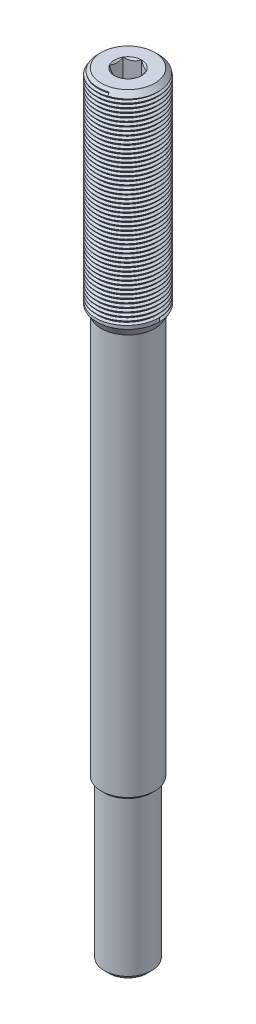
SolidWorks part; units mm, degrees
ref_plane "前视基准面" through (0, 0, 0) normal (0, 0, 1) x (1, 0, 0)
ref_plane "上视基准面" through (0, 0, 0) normal (0, 1, 0) x (1, 0, 0)
ref_plane "右视基准面" through (0, 0, 0) normal (1, 0, 0) x (0, 0, -1)
other "Configuration Table"
sketch "草图1" plane through (0, 0, 0) normal (0, 0, 1) x (1, 0, 0)
  line L0 (0, 12.4914) -> (0, -8.2512) construction
  line L1 (0, 49.3) -> (-2, 49.3)
  line L2 (-2, 49.3) -> (-2, 36.3)
  line L3 (-2, 36.3) -> (-1.7, 35.7804)
  line L4 (-1.7, 35.7804) -> (-1.7, 10)
  line L5 (-1.7, 10) -> (-1.5, 10)
  line L6 (-1.5, 10) -> (-1.5, 0)
  line L7 (-1.5, 0) -> (0, 0)
  line L8 (0, 49.3) -> (0, 0)
  dimension "D1" = 2
  dimension "D2" = 1.7
  dimension "D3" = 1.5
  dimension "D4" = 10
  dimension "D5" = 30
  dimension "D6" = 49.3
  dimension "D7" = 13
revolve "旋转1" add sketch "草图1" angle 360 about L0
sketch "草图2" plane through (0, 49.3, 0) normal (0, 1, 0) x (1, 0, 0)
  line L0 (0, 1.8266) -> (0, -1.1214) construction
  line L2 (0, -0.866) -> (0.75, -0.433)
  line L3 (0.75, -0.433) -> (0.75, 0.433)
  line L4 (0.75, 0.433) -> (0, 0.866)
  line L5 (0, 0.866) -> (-0.75, 0.433)
  line L6 (-0.75, 0.433) -> (-0.75, -0.433)
  line L7 (-0.75, -0.433) -> (0, -0.866)
  circle A0 centre (0, 0) radius 0.75 construction
  dimension "D1" = 1.5
extrude "切除-拉伸1" cut sketch "草图2" against normal blind 3
chamfer "倒角1" distance 0.3 angle 45 3 edges at (0, 49.3, 2) (0, 0, 1.5) (0, 10, 1.7)
thread "螺纹线1" pitch 0.25 start angle 0, offset 0, length 0, pitch 0.25, diameter 4
ref_plane "基准面1" through (2, 36.3, 0) normal (0, 0, 1) x (1, 0, 0)
sketch "螺纹线轮廓1" plane through (2, 36.3, 0) normal (0, 0, 1) x (1, 0, 0)
  line L0 (0, 0) -> (0, 0.25) construction
  line L11 (0, 0) -> (0, 0.2187)
  line L12 (0, 0.2187) -> (-0.1353, 0.1406)
  line L13 (-0.1353, 0.1406) -> (-0.1353, 0.0781)
  line L15 (-0.1353, 0.0781) -> (0, 0)
  line L17 (-0.1353, 0.1094) -> (0, 0.1094) construction
  point P2 (0, 0)
  dimension "Pitch" = 0.25
  dimension "Profile_Angle" = 60
  dimension "Profile_Land" = 0.0625
  dimension "Profile_Height" = 0.1353
sketch "草图4" plane through (0, 49.3, 0) normal (0, 1, 0) x (1, 0, 0)
  circle A0 centre (0, 0) radius 0.866
extrude "切除-拉伸2" cut sketch "草图4" against normal through all draft 45
